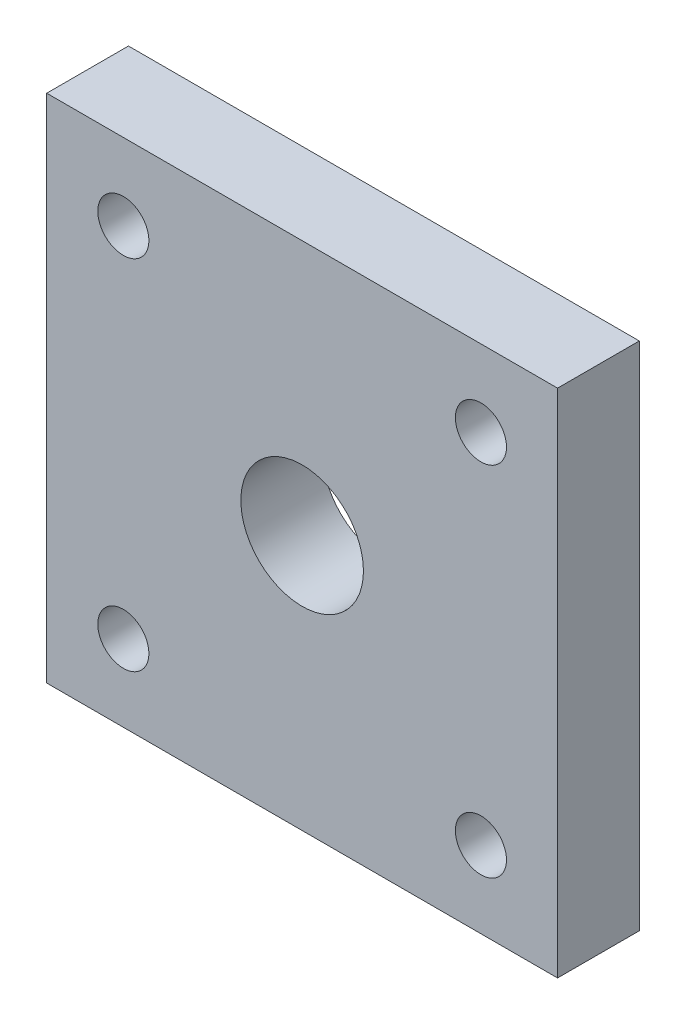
SolidWorks part; units mm, degrees
ref_plane "Front Plane" through (0, 0, 0) normal (0, 0, 1) x (1, 0, 0)
ref_plane "Top Plane" through (0, 0, 0) normal (0, 1, 0) x (1, 0, 0)
ref_plane "Right Plane" through (0, 0, 0) normal (1, 0, 0) x (0, 0, -1)
sketch "Sketch1" plane through (0, 0, 0) normal (0, 0, 1) x (1, 0, 0)
  line L1 (-25, -25) -> (25, -25)
  line L2 (-25, -25) -> (-25, 25)
  line L3 (-25, 25) -> (25, 25)
  line L4 (25, -25) -> (25, 25)
  line L5 (-25, -25) -> (25, 25) construction
  line L6 (-25, 25) -> (25, -25) construction
  point P0 (0, 0)
  dimension "D1" = 50
  dimension "D2" = 50
extrude "Boss-Extrude1" add sketch "Sketch1" along normal blind 8
sketch "Sketch2" plane through (0, 0, 8) normal (0, 0, 1) x (1, 0, 0)
  circle A0 centre (0, 0) radius 6
  dimension "D1" = 12
extrude "Cut-Extrude1" cut sketch "Sketch2" against normal blind 8
sketch "Sketch7" plane through (0, 0, 8) normal (0, 0, 1) x (1, 0, 0)
  point P0 (17.5, 17.5)
  point P1 (17.5, -17.5)
  point P2 (-17.5, -17.5)
  point P3 (-17.5, 17.5)
  dimension "D1" = 35
  dimension "D2" = 35
  dimension "D3" = 35
  dimension "D4" = 35
  dimension "D5" = 17.5
  dimension "D6" = 17.5
hole_wizard "M6 Tapped Hole1" positions "Sketch8" profile "Sketch9" tap size "M6" standard "DIN"
sketch "Sketch8" plane through (0, 0, 8) normal (0, 0, 1) x (1, 0, 0)
  point P0 (17.5, 17.5)
  point P3 (17.5, -17.5)
  point P6 (-17.5, -17.5)
  point P9 (-17.5, 17.5)
sketch "Sketch9" plane through (17.5, 17.5, 8) normal (1, 0, 0) x (0, -1, 0)
  line L0 (0, 0) -> (0, 8)
  line L1 (0, 8) -> (2.5, 8)
  line L2 (2.5, 8) -> (2.5, 0)
  line L5 (2.5, 0) -> (0, 0)
  line L11 (0, -6.35) -> (0, 107.95) construction
  dimension "Thru Tap Drill Dia." = 5
  dimension "Thru Tap Drill Depth" = 8
